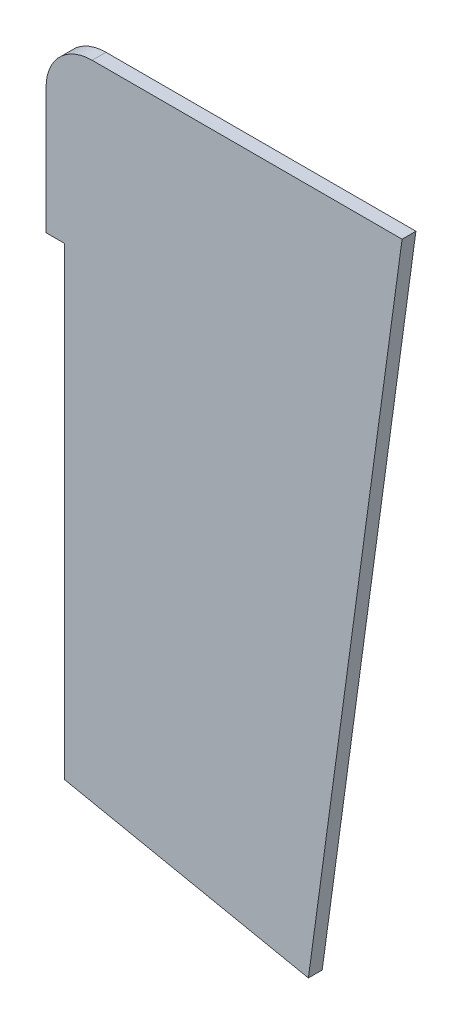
SolidWorks part; units mm, degrees
ref_plane "Plano frontal" through (0, 0, 0) normal (0, 0, 1) x (1, 0, 0)
ref_plane "Plano superior" through (0, 0, 0) normal (0, 1, 0) x (1, 0, 0)
ref_plane "Plano direito" through (0, 0, 0) normal (1, 0, 0) x (0, 0, -1)
sketch "Esboço2" plane through (0, 0, 0) normal (0, 0, 1) x (1, 0, 0)
  line L0 (236.7447, 297.9799) -> (179.7973, 309.6325)
  line L1 (179.7973, 309.6325) -> (179.7973, 447.074)
  line L3 (179.7973, 447.074) -> (257.0903, 447.074)
  line L4 (257.0903, 447.074) -> (236.7447, 297.9799)
extrude "Ressalto-extrusão1" add sketch "Esboço2" against normal blind 3
fillet "Filete1" radius 10 1 edges at (179.7973, 447.074, -1.5)
sketch "Esboço5" plane through (179.7973, 0, 0) normal (-1, 0, 0) x (0, 0, 1)
  line L0 (-1000.4494, 309.6325) -> (48999.5506, 309.6325) construction
  line L2 (-1000.4494, 409.6325) -> (48999.5506, 409.6325) construction
  line L4 (-3, 409.6325) -> (0, 409.6325)
  line L5 (-3, 409.6325) -> (-3.5446, 304.9849)
  line L6 (-3.5446, 304.9849) -> (0.3693, 304.9849)
  line L7 (0, 409.6325) -> (0.3693, 304.9849)
  line L8 (-3, 409.6325) -> (0.3693, 304.9849) construction
  line L9 (-3.5446, 304.9849) -> (0, 409.6325) construction
  point P8 (-1.5, 359.6325)
  point P9 (-3.5446, 304.9849)
  point P10 (0.3693, 304.9849)
extrude "Corte-extrusão3" cut sketch "Esboço5" against normal blind 4
